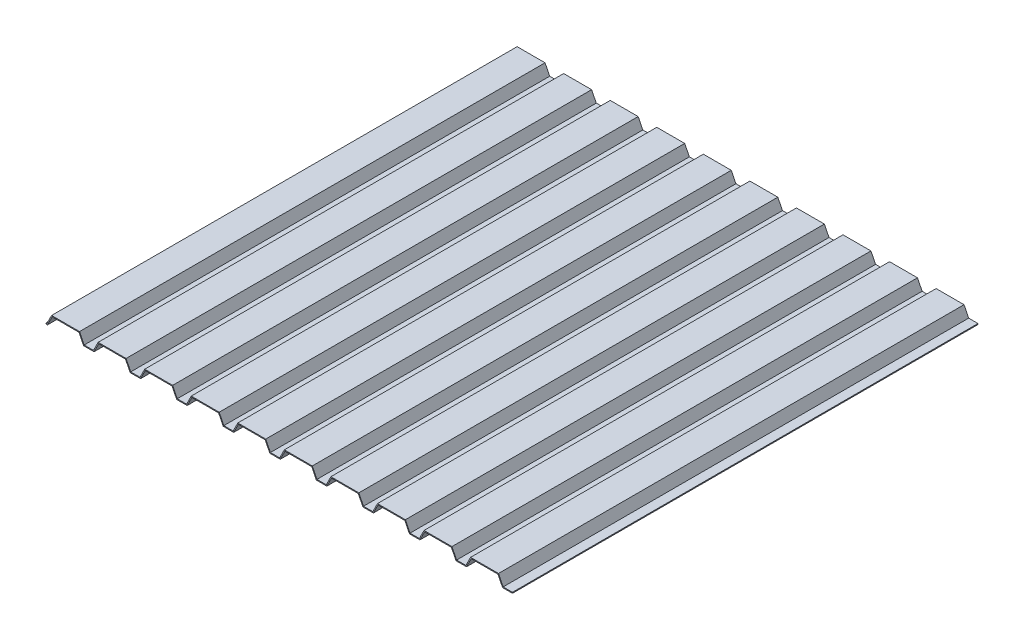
SolidWorks part; units mm, degrees
ref_plane "Ebene vorne" through (0, 0, 0) normal (0, 0, 1) x (1, 0, 0)
ref_plane "Ebene oben" through (0, 0, 0) normal (0, 1, 0) x (1, 0, 0)
ref_plane "Ebene rechts" through (0, 0, 0) normal (1, 0, 0) x (0, 0, -1)
sketch "Skizze1" plane through (0, 0, 0) normal (0, 0, 1) x (1, 0, 0)
  line L0 (0, 0) -> (5, 10)
  line L1 (5, 10) -> (35, 10)
  line L2 (35, 10) -> (40, 0)
  line L3 (40, 0) -> (50, 0)
  line L4 (0, 0) -> (-1, 0)
  dimension "D1" = 10
  dimension "D2" = 30
  dimension "D3" = 10
  dimension "D4" = 50
  dimension "D5" = 1
extrude "Linear-Austragen-Dünn1" add sketch "Skizze1" along normal blind 500 thin
pattern_linear "Lineares Muster2" count 10 spacing 50 along (-1, 0, 0) of "Linear-Austragen-Dünn1"
